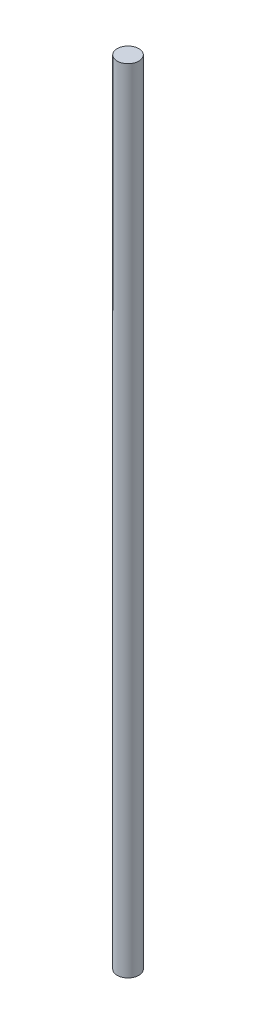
SolidWorks part; units mm, degrees
ref_plane "Front Plane" through (0, 0, 0) normal (0, 0, 1) x (1, 0, 0)
ref_plane "Top Plane" through (0, 0, 0) normal (0, 1, 0) x (1, 0, 0)
ref_plane "Right Plane" through (0, 0, 0) normal (1, 0, 0) x (0, 0, -1)
sketch "Sketch1" plane through (0, 0, 0) normal (0, 1, 0) x (1, 0, 0)
  circle A0 centre (0, 0) radius 5
  dimension "D1" = 10
extrude "Boss-Extrude1" add sketch "Sketch1" along normal blind 365.6
